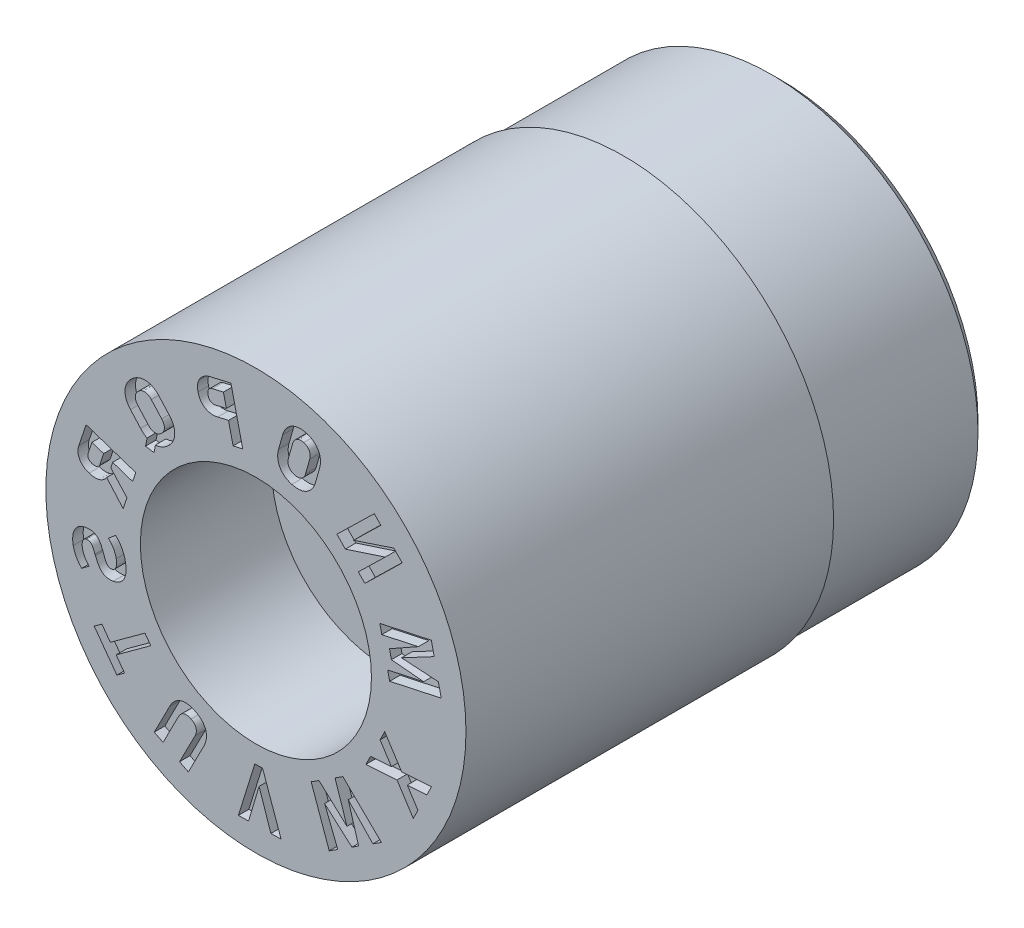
SolidWorks part; units mm, degrees
ref_plane "Front Plane" through (0, 0, 0) normal (0, 0, 1) x (1, 0, 0)
ref_plane "Top Plane" through (0, 0, 0) normal (0, 1, 0) x (1, 0, 0)
ref_plane "Right Plane" through (0, 0, 0) normal (1, 0, 0) x (0, 0, -1)
sketch "Sketch1" plane through (0, 0, 0) normal (1, 0, 0) x (0, 0, -1)
  line L2 (0, 4) -> (0, 2.2)
  line L3 (9.75, 4) -> (0, 4)
  line L4 (-3.7979, 0) -> (49996.2021, 0) construction
  line L8 (10, 1.15) -> (2.5, 1.15)
  line L9 (2.5, 2.2) -> (2.5, 1.15)
  line L10 (2.5, 2.2) -> (0, 2.2)
  line L12 (10, 1.15) -> (10, 3.75)
  line L16 (10, 3.75) -> (9.75, 4)
  dimension "D1" = 10
  dimension "D2" = 45
  dimension "D3" = 0.25
  dimension "D4" = 8
  dimension "D5" = 4.4
  dimension "D6" = 2.5
  dimension "D7" = 2.3
revolve "Revolve1" add sketch "Sketch1" angle 360 about L4
sketch "Sketch4" plane through (0, 0, 0) normal (1, 0, 0) x (0, 0, -1)
  line L0 (0, 0) -> (50000, 0) construction
  line L1 (10, -3.75) -> (10, 3.75) construction
  line L2 (7, 4.935) -> (10, 4.935)
  line L3 (7, 4.935) -> (7, 3.935)
  line L4 (7, 3.935) -> (10, 3.935)
  line L5 (10, 4.935) -> (10, 3.935)
  line L6 (9.75, 4) -> (0, 4) construction
  line L9 (0, 4.4) -> (0, -4.4) construction
  dimension "D1" = 1
  dimension "D2" = 0.065
  dimension "D3" = 7
revolve "Cut-Revolve1" cut sketch "Sketch4" angle 360 about L0
sketch "Sketch6" plane through (0, 0, 0) normal (0, 0, 1) x (1, 0, 0)
  line L0 (3.3942, 0.938) -> (3.3414, 1.1817)
  line L1 (3.3414, 1.1817) -> (2.36, 0.9694)
  line L2 (2.36, 0.9694) -> (2.3964, 0.8013)
  line L3 (2.3964, 0.8013) -> (3.094, 0.9523)
  line L5 (3.094, 0.9523) -> (2.545, 0.644)
  line L6 (2.545, 0.644) -> (2.5803, 0.4808)
  line L7 (2.5803, 0.4808) -> (3.1942, 0.4242)
  line L9 (3.1942, 0.4242) -> (2.51, 0.2761)
  line L10 (2.51, 0.2761) -> (2.5465, 0.108)
  line L11 (2.5465, 0.108) -> (3.5279, 0.3204)
  line L12 (3.5279, 0.3204) -> (3.4751, 0.564)
  line L13 (3.4751, 0.564) -> (2.7731, 0.6079)
  line L14 (2.7731, 0.6079) -> (3.3942, 0.938)
  line L15 (2.7863, 2.1794) -> (2.6263, 2.3435)
  line L16 (2.6263, 2.3435) -> (1.8581, 2.0885)
  line L18 (1.8581, 2.0885) -> (2.3794, 2.5967)
  line L19 (2.3794, 2.5967) -> (2.2542, 2.7252)
  line L20 (2.2542, 2.7252) -> (1.5424, 2.0312)
  line L21 (1.5424, 2.0312) -> (1.7034, 1.8661)
  line L22 (1.7034, 1.8661) -> (2.4633, 2.1147)
  line L24 (2.4633, 2.1147) -> (1.9495, 1.6137)
  line L25 (1.9495, 1.6137) -> (2.0745, 1.4854)
  line L26 (2.0745, 1.4854) -> (2.7863, 2.1794)
  line L27 (1.1352, 2.6801) -> (1.2122, 2.9529)
  line L28 (0.5092, 3.1513) -> (0.4321, 2.8786)
  line L29 (0.6188, 2.821) -> (0.6984, 3.1029)
  line L30 (1.0255, 3.0108) -> (0.9459, 2.7288)
  line L31 (-0.5623, 3.0525) -> (-0.7736, 3.0037)
  line L32 (-0.8295, 3.2458) -> (-0.6181, 3.2946)
  line L33 (-0.5216, 2.876) -> (-0.4345, 2.4988)
  line L34 (-2.072, 1.8105) -> (-2.1007, 1.662)
  line L35 (-0.7282, 2.8284) -> (-0.5216, 2.876)
  line L36 (-2.7277, 1.0821) -> (-2.3476, 0.9544)
  line L37 (-0.4756, 3.5133) -> (-0.8655, 3.4234)
  line L38 (-0.6181, 3.2946) -> (-0.5623, 3.0525)
  line L39 (-0.4345, 2.4988) -> (-0.2513, 2.541)
  line L40 (-0.2513, 2.541) -> (-0.4756, 3.5133)
  line L41 (-2.7722, -1.9089) -> (-2.9326, -1.6891)
  line L43 (-2.1007, 1.662) -> (-1.9397, 1.6333)
  line L44 (-1.9397, 1.6333) -> (-1.9124, 1.7752)
  line L45 (-1.6506, 2.3993) -> (-1.8409, 2.6116)
  line L46 (-2.388, 2.1211) -> (-2.1976, 1.9087)
  line L47 (-2.048, 2.0363) -> (-2.2447, 2.2557)
  line L48 (-1.9904, 2.4839) -> (-1.7937, 2.2644)
  line L49 (-2.8992, 1.1397) -> (-2.9736, 0.918)
  line L50 (-3.1957, 0.9928) -> (-3.1213, 1.2143)
  line L53 (-2.764, 0.974) -> (-2.7277, 1.0821)
  line L55 (-3.2331, 1.4498) -> (-3.3721, 1.036)
  line L56 (-3.1213, 1.2143) -> (-2.8992, 1.1397)
  line L57 (-2.3476, 0.9544) -> (-2.2877, 1.1322)
  line L58 (-2.2877, 1.1322) -> (-3.2331, 1.4498)
  line L60 (-2.8414, 0.7741) -> (-2.5279, 0.4177)
  line L61 (-2.5279, 0.4177) -> (-2.4555, 0.6334)
  line L62 (-2.4555, 0.6334) -> (-2.764, 0.974)
  line L63 (-2.6725, -0.0966) -> (-2.8093, -0.2101)
  line L64 (-2.7432, -0.6878) -> (-2.7438, -0.6878)
  line L65 (-2.8933, -0.5296) -> (-2.8982, -0.5151)
  line L66 (-3.2424, -0.2484) -> (-3.2431, -0.2487)
  line L67 (-3.3182, -0.9623) -> (-3.1757, -0.8554)
  line L68 (-3.2273, -0.4356) -> (-3.2267, -0.4354)
  line L69 (-2.7142, -0.8723) -> (-2.7128, -0.872)
  line L71 (-2.6614, -2.0609) -> (-2.0014, -1.5793)
  line L72 (-2.0014, -1.5793) -> (-2.1123, -1.4274)
  line L73 (-2.1123, -1.4274) -> (-2.7722, -1.9089)
  line L74 (-3.0791, -1.796) -> (-2.6478, -2.3873)
  line L75 (-2.6478, -2.3873) -> (-2.5012, -2.2805)
  line L76 (-2.5012, -2.2805) -> (-2.6614, -2.0609)
  line L77 (-2.9326, -1.6891) -> (-3.0791, -1.796)
  line L78 (-1.6441, -2.4041) -> (-1.9353, -2.9715)
  line L79 (-1.9353, -2.9715) -> (-1.7678, -3.0576)
  line L80 (-1.7678, -3.0576) -> (-1.4744, -2.4858)
  line L81 (-1.1601, -2.6471) -> (-1.4535, -3.2189)
  line L82 (-1.4535, -3.2189) -> (-1.2858, -3.3048)
  line L83 (-1.2858, -3.3048) -> (-0.9946, -2.7373)
  line L84 (-0.3338, -3.5443) -> (-0.1398, -3.5405)
  line L85 (-0.1398, -3.5405) -> (0.0596, -2.8694)
  line L86 (0.0596, -2.8694) -> (0.2851, -3.5322)
  line L87 (0.2851, -3.5322) -> (0.4791, -3.5284)
  line L88 (0.4791, -3.5284) -> (0.1269, -2.535)
  line L89 (0.1269, -2.535) -> (-0.0205, -2.5378)
  line L90 (-0.0205, -2.5378) -> (-0.3338, -3.5443)
  line L91 (1.829, -2.9867) -> (1.9564, -2.9054)
  line L92 (1.9564, -2.9054) -> (1.7582, -2.24)
  line L93 (1.7582, -2.24) -> (2.2261, -2.733)
  line L94 (2.2261, -2.733) -> (2.3895, -2.6285)
  line L95 (2.3895, -2.6285) -> (1.6565, -1.9099)
  line L96 (1.6565, -1.9099) -> (1.507, -2.0055)
  line L97 (1.507, -2.0055) -> (1.7339, -2.6898)
  line L98 (1.7339, -2.6898) -> (1.201, -2.2011)
  line L99 (1.201, -2.2011) -> (1.0515, -2.2967)
  line L100 (1.0515, -2.2967) -> (1.396, -3.2637)
  line L101 (1.396, -3.2637) -> (1.5595, -3.1592)
  line L102 (1.5595, -3.1592) -> (1.3084, -2.5276)
  line L103 (1.3084, -2.5276) -> (1.829, -2.9867)
  line L105 (2.6868, -1.4487) -> (2.9966, -1.929)
  line L106 (2.9966, -1.929) -> (3.0857, -1.7505)
  line L107 (3.0857, -1.7505) -> (2.8824, -1.4356)
  line L109 (2.7753, -1.2702) -> (2.4532, -0.7707)
  line L110 (2.4532, -0.7707) -> (2.364, -0.949)
  line L111 (2.364, -0.949) -> (2.5801, -1.2832)
  line L112 (2.8824, -1.4356) -> (3.2553, -1.4106)
  line L113 (3.2553, -1.4106) -> (3.3443, -1.2321)
  line L114 (3.3443, -1.2321) -> (2.7753, -1.2702)
  line L115 (2.5801, -1.2832) -> (2.184, -1.3097)
  line L116 (2.184, -1.3097) -> (2.0949, -1.4882)
  line L117 (2.0949, -1.4882) -> (2.6868, -1.4487)
  spline S0 degree 3 poles (0.6836, 2.4244) (0.7006, 2.4198) (0.7259, 2.4135) (0.76, 2.4093) (0.7848, 2.4075) (0.8093, 2.4071) (0.8333, 2.4084) (0.857, 2.4115) (0.8803, 2.416) (0.9029, 2.4222) (0.9248, 2.4299) (0.946, 2.4387) (0.9661, 2.4495) (0.9856, 2.4614) (1.0043, 2.4748) (1.0221, 2.4898) (1.0392, 2.5059) (1.0552, 2.5236) (1.0701, 2.5424) (1.0837, 2.5625) (1.0965, 2.5836) (1.1078, 2.6061) (1.1217, 2.638) (1.1305, 2.6629) (1.1352, 2.6801) knots 0 0 0 0 0.090194 0.133726 0.176131 0.217857 0.25895 0.299614 0.340319 0.380513 0.420146 0.459126 0.498043 0.537171 0.576533 0.615884 0.6563 0.697112 0.738186 0.77937 0.821548 0.864563 0.908535 1 1 1 1
  spline S1 degree 3 poles (1.2122, 2.9529) (1.217, 2.97) (1.2226, 2.9959) (1.2278, 3.0303) (1.2294, 3.0554) (1.23, 3.0801) (1.2284, 3.1043) (1.2258, 3.1282) (1.2212, 3.1515) (1.2154, 3.1743) (1.2078, 3.1963) (1.199, 3.2176) (1.1887, 3.238) (1.1767, 3.2575) (1.1637, 3.2764) (1.1489, 3.2942) (1.1328, 3.3112) (1.1155, 3.3274) (1.0967, 3.3421) (1.0769, 3.3558) (1.0561, 3.3687) (1.034, 3.38) (1.0025, 3.3936) (0.9779, 3.4023) (0.9609, 3.407) knots 0 0 0 0 0.091422 0.135457 0.178647 0.220379 0.261961 0.303177 0.343652 0.383839 0.423698 0.462887 0.502168 0.540991 0.580175 0.619644 0.659728 0.70027 0.741002 0.782211 0.823695 0.866341 0.909628 1 1 1 1
  spline S2 degree 3 poles (0.9609, 3.407) (0.9439, 3.4116) (0.9184, 3.418) (0.8843, 3.4221) (0.8595, 3.4243) (0.8351, 3.4243) (0.811, 3.4231) (0.7873, 3.42) (0.764, 3.4155) (0.7414, 3.4092) (0.7195, 3.4018) (0.6985, 3.3927) (0.6781, 3.3823) (0.6586, 3.3704) (0.6401, 3.3567) (0.622, 3.342) (0.6052, 3.3255) (0.5891, 3.3079) (0.5743, 3.289) (0.5603, 3.2692) (0.5479, 3.2478) (0.5363, 3.2255) (0.5224, 3.1936) (0.5139, 3.1685) (0.5092, 3.1513) knots 0 0 0 0 0.090479 0.133987 0.176211 0.218094 0.259165 0.299808 0.340491 0.380664 0.420007 0.45925 0.498027 0.537135 0.576341 0.616114 0.656419 0.69721 0.738262 0.779443 0.821603 0.864569 0.908518 1 1 1 1
  spline S3 degree 3 poles (0.4321, 2.8786) (0.4272, 2.8615) (0.4213, 2.8357) (0.4166, 2.8013) (0.4147, 2.7762) (0.4144, 2.7515) (0.4157, 2.7272) (0.4184, 2.7033) (0.4231, 2.68) (0.4289, 2.6572) (0.4363, 2.6352) (0.4452, 2.614) (0.4557, 2.5937) (0.4673, 2.574) (0.4807, 2.5554) (0.4953, 2.5373) (0.5115, 2.5203) (0.5288, 2.5041) (0.5476, 2.4894) (0.5673, 2.4756) (0.5883, 2.4631) (0.6103, 2.4514) (0.642, 2.4378) (0.6666, 2.4291) (0.6836, 2.4244) knots 0 0 0 0 0.091282 0.135439 0.178142 0.220334 0.261702 0.302901 0.343595 0.383766 0.423341 0.462797 0.501584 0.540552 0.579582 0.619478 0.659546 0.700072 0.740788 0.78198 0.823449 0.866054 0.909669 1 1 1 1
  spline S4 degree 3 poles (0.7347, 2.606) (0.7192, 2.6101) (0.6972, 2.6191) (0.671, 2.6359) (0.6542, 2.6505) (0.64, 2.6671) (0.6283, 2.6853) (0.6196, 2.7052) (0.6134, 2.7265) (0.6103, 2.7491) (0.6099, 2.781) (0.6144, 2.8051) (0.6188, 2.821) knots 0 0 0 0 0.175128 0.257335 0.337663 0.417031 0.494508 0.572748 0.652927 0.735489 0.820321 1 1 1 1
  spline S5 degree 3 poles (0.6984, 3.1029) (0.703, 3.1188) (0.7118, 3.1415) (0.7286, 3.1686) (0.7432, 3.1861) (0.7595, 3.2012) (0.7775, 3.2134) (0.7967, 3.2232) (0.8177, 3.2295) (0.8396, 3.2334) (0.8707, 3.2342) (0.8942, 3.2301) (0.9097, 3.2257) knots 0 0 0 0 0.179644 0.264038 0.346325 0.427164 0.505034 0.582875 0.661567 0.742349 0.824682 1 1 1 1
  spline S6 degree 3 poles (0.9097, 3.2257) (0.9253, 3.2217) (0.9472, 3.2125) (0.9735, 3.1958) (0.99, 3.1809) (1.0045, 3.1646) (1.016, 3.1463) (1.0249, 3.1264) (1.0308, 3.105) (1.0342, 3.0825) (1.0341, 3.0507) (1.03, 3.0266) (1.0255, 3.0108) knots 0 0 0 0 0.175239 0.25749 0.337988 0.417174 0.494693 0.572977 0.6537 0.735737 0.820223 1 1 1 1
  spline S7 degree 3 poles (0.9459, 2.7288) (0.9415, 2.7129) (0.9325, 2.6901) (0.9158, 2.6629) (0.9012, 2.6454) (0.8849, 2.6304) (0.867, 2.6182) (0.8476, 2.6085) (0.8268, 2.6019) (0.8047, 2.5983) (0.7736, 2.5976) (0.7501, 2.6014) (0.7347, 2.606) knots 0 0 0 0 0.179767 0.264884 0.347153 0.427263 0.505116 0.58294 0.662174 0.742451 0.825387 1 1 1 1
  spline S8 degree 3 poles (-0.7736, 3.0037) (-0.784, 3.0015) (-0.7997, 2.9994) (-0.8204, 3.0013) (-0.835, 3.0051) (-0.8489, 3.0105) (-0.8617, 3.0183) (-0.8736, 3.0275) (-0.8842, 3.0388) (-0.8937, 3.0516) (-0.9043, 3.0712) (-0.91, 3.0873) (-0.9123, 3.0986) knots 0 0 0 0 0.168779 0.249596 0.328432 0.407062 0.48572 0.564814 0.646319 0.730711 0.817085 1 1 1 1
  spline S9 degree 3 poles (-0.9123, 3.0986) (-0.9149, 3.11) (-0.9174, 3.1271) (-0.9165, 3.1496) (-0.9137, 3.1654) (-0.9093, 3.1803) (-0.9029, 3.194) (-0.8946, 3.2065) (-0.8846, 3.2175) (-0.8732, 3.2273) (-0.8551, 3.238) (-0.8401, 3.2435) (-0.8295, 3.2458) knots 0 0 0 0 0.184525 0.269847 0.354276 0.436138 0.514601 0.592866 0.670246 0.748708 0.829399 1 1 1 1
  spline S10 degree 3 poles (-0.8655, 3.4234) (-0.8943, 3.4171) (-0.9354, 3.4029) (-0.985, 3.3749) (-1.0172, 3.3503) (-1.0455, 3.3223) (-1.0688, 3.291) (-1.0877, 3.2569) (-1.1011, 3.22) (-1.11, 3.1809) (-1.114, 3.1252) (-1.109, 3.0828) (-1.1023, 3.0548) knots 0 0 0 0 0.179264 0.262914 0.345095 0.425467 0.504018 0.581987 0.661489 0.742357 0.824785 1 1 1 1
  spline S11 degree 3 poles (-1.1023, 3.0548) (-1.0957, 3.0268) (-1.0821, 2.9863) (-1.0538, 2.9382) (-1.0288, 2.9071) (-1.0004, 2.88) (-0.9687, 2.8577) (-0.934, 2.8401) (-0.8966, 2.8271) (-0.8568, 2.8196) (-0.8001, 2.816) (-0.7569, 2.8216) (-0.7282, 2.8284) knots 0 0 0 0 0.175741 0.257985 0.339044 0.418176 0.496191 0.574525 0.654742 0.736636 0.820446 1 1 1 1
  spline S12 degree 3 poles (-1.6766, 1.8779) (-1.6633, 1.8896) (-1.6447, 1.9082) (-1.6224, 1.9346) (-1.6076, 1.9549) (-1.5942, 1.9755) (-1.5823, 1.9967) (-1.5722, 2.0185) (-1.5635, 2.0407) (-1.5566, 2.0633) (-1.5511, 2.0859) (-1.5476, 2.1087) (-1.5458, 2.1315) (-1.5451, 2.1545) (-1.5465, 2.1776) (-1.5498, 2.2007) (-1.5543, 2.2239) (-1.5607, 2.247) (-1.5685, 2.2698) (-1.5783, 2.2923) (-1.5895, 2.3144) (-1.6024, 2.3362) (-1.6219, 2.3653) (-1.6388, 2.3858) (-1.6506, 2.3993) knots 0 0 0 0 0.090248 0.133974 0.176351 0.21819 0.259184 0.300165 0.340676 0.380906 0.42036 0.459207 0.498376 0.537338 0.576359 0.616026 0.656354 0.696955 0.738027 0.779458 0.821744 0.864572 0.908583 1 1 1 1
  spline S13 degree 3 poles (-1.8409, 2.6116) (-1.8527, 2.6252) (-1.8718, 2.6437) (-1.8983, 2.6666) (-1.9187, 2.6815) (-1.9395, 2.6951) (-1.9608, 2.7072) (-1.9826, 2.7176) (-2.0048, 2.7264) (-2.0274, 2.7336) (-2.05, 2.7393) (-2.0728, 2.743) (-2.0958, 2.7451) (-2.1187, 2.7456) (-2.1417, 2.7444) (-2.1648, 2.7417) (-2.1879, 2.737) (-2.2109, 2.7308) (-2.2336, 2.723) (-2.2559, 2.7135) (-2.278, 2.7026) (-2.2996, 2.69) (-2.3284, 2.6707) (-2.3487, 2.654) (-2.362, 2.6423) knots 0 0 0 0 0.0915 0.135421 0.178271 0.220577 0.262026 0.303121 0.343723 0.384021 0.423519 0.46273 0.501891 0.540855 0.57982 0.619323 0.659322 0.699924 0.740535 0.781797 0.823416 0.866037 0.909561 1 1 1 1
  spline S14 degree 3 poles (-2.362, 2.6423) (-2.3749, 2.6302) (-2.3941, 2.6122) (-2.416, 2.5854) (-2.431, 2.5653) (-2.4444, 2.5448) (-2.4562, 2.5235) (-2.4664, 2.5018) (-2.475, 2.4796) (-2.482, 2.4571) (-2.4874, 2.4345) (-2.4912, 2.4117) (-2.4931, 2.3888) (-2.4934, 2.3658) (-2.492, 2.3428) (-2.4891, 2.3196) (-2.4842, 2.2965) (-2.478, 2.2734) (-2.47, 2.2505) (-2.4603, 2.2281) (-2.4491, 2.2059) (-2.4362, 2.1841) (-2.4167, 2.1551) (-2.3998, 2.1346) (-2.388, 2.1211) knots 0 0 0 0 0.090259 0.133806 0.176368 0.21791 0.259235 0.299899 0.340421 0.380663 0.420128 0.459002 0.498182 0.537187 0.576219 0.615813 0.656259 0.696871 0.737954 0.779397 0.821695 0.864534 0.908558 1 1 1 1
  spline S15 degree 3 poles (-2.1976, 1.9087) (-2.1859, 1.8952) (-2.1668, 1.8766) (-2.1403, 1.8538) (-2.12, 1.8386) (-2.099, 1.8253) (-2.083, 1.8161) (-2.0739, 1.8115) (-2.072, 1.8105) knots 0 0 0 0 0.091507 0.13543 0.178459 0.220612 0.262064 0.272766 0.272766 0.272766 0.272766
  spline S16 degree 3 poles (-1.8032, 2.019) (-1.8153, 2.0082) (-1.8346, 1.9942) (-1.8629, 1.981) (-1.8844, 1.9749) (-1.9061, 1.9714) (-1.9279, 1.9714) (-1.9495, 1.9746) (-1.9708, 1.981) (-1.9917, 1.9902) (-2.0189, 2.0072) (-2.0371, 2.0237) (-2.048, 2.0363) knots 0 0 0 0 0.175141 0.256784 0.337393 0.416764 0.494645 0.572816 0.652902 0.735639 0.819694 1 1 1 1
  spline S17 degree 3 poles (-2.2447, 2.2557) (-2.2559, 2.268) (-2.2703, 2.2879) (-2.2845, 2.3167) (-2.2915, 2.3384) (-2.2955, 2.3603) (-2.2965, 2.3822) (-2.294, 2.4039) (-2.2883, 2.4252) (-2.2797, 2.4459) (-2.2636, 2.4726) (-2.2477, 2.4904) (-2.2356, 2.5012) knots 0 0 0 0 0.180084 0.264435 0.346804 0.426691 0.504877 0.582908 0.66255 0.743143 0.824841 1 1 1 1
  spline S18 degree 3 poles (-2.2356, 2.5012) (-2.2235, 2.5118) (-2.2042, 2.5261) (-2.1757, 2.539) (-2.1543, 2.5456) (-2.1325, 2.5486) (-2.1107, 2.5488) (-2.089, 2.5455) (-2.0677, 2.5392) (-2.0468, 2.5299) (-2.0199, 2.5125) (-2.0013, 2.4965) (-1.9904, 2.4839) knots 0 0 0 0 0.174919 0.257092 0.337885 0.416967 0.49475 0.573558 0.653542 0.735473 0.819742 1 1 1 1
  spline S19 degree 3 poles (-1.7937, 2.2644) (-1.7824, 2.2522) (-1.7683, 2.2322) (-1.7541, 2.2035) (-1.7471, 2.1817) (-1.7431, 2.1598) (-1.7421, 2.138) (-1.7445, 2.1163) (-1.7503, 2.0951) (-1.7589, 2.0744) (-1.7753, 2.0477) (-1.7911, 2.0297) (-1.8032, 2.019) knots 0 0 0 0 0.179662 0.264031 0.346417 0.426321 0.504524 0.582571 0.661503 0.742112 0.824804 1 1 1 1
  spline S20 degree 3 poles (-2.9736, 0.918) (-2.9764, 0.9093) (-2.9823, 0.897) (-2.9935, 0.8831) (-3.0033, 0.8744) (-3.0142, 0.8671) (-3.0261, 0.8612) (-3.0393, 0.8575) (-3.0534, 0.8553) (-3.0682, 0.8545) (-3.0893, 0.8563) (-3.1051, 0.8595) (-3.1156, 0.863) knots 0 0 0 0 0.161068 0.23633 0.312907 0.389938 0.4663 0.546541 0.629301 0.716596 0.806348 1 1 1 1
  spline S21 degree 3 poles (-3.1156, 0.863) (-3.126, 0.8667) (-3.1411, 0.8727) (-3.1587, 0.8844) (-3.1702, 0.8938) (-3.1801, 0.9041) (-3.1884, 0.9151) (-3.1943, 0.9271) (-3.1987, 0.9394) (-3.2011, 0.9524) (-3.2015, 0.9704) (-3.1989, 0.984) (-3.1957, 0.9928) knots 0 0 0 0 0.193239 0.282531 0.369322 0.452324 0.53163 0.608138 0.685234 0.760908 0.836972 1 1 1 1
  spline S22 degree 3 poles (-3.3721, 1.036) (-3.3806, 1.0114) (-3.3885, 0.9736) (-3.3892, 0.9231) (-3.384, 0.8871) (-3.3741, 0.8526) (-3.3593, 0.8198) (-3.3395, 0.7895) (-3.3153, 0.7614) (-3.2866, 0.7359) (-3.242, 0.7053) (-3.2038, 0.6889) (-3.1772, 0.6798) knots 0 0 0 0 0.170636 0.251235 0.330356 0.408725 0.48632 0.565007 0.645709 0.729339 0.815469 1 1 1 1
  spline S23 degree 3 poles (-3.1772, 0.6798) (-3.1506, 0.6708) (-3.1103, 0.6612) (-3.0563, 0.6587) (-3.0182, 0.6618) (-2.9818, 0.6694) (-2.9477, 0.6819) (-2.9161, 0.699) (-2.8872, 0.7205) (-2.8622, 0.7458) (-2.8477, 0.7645) (-2.8414, 0.7741) knots 0 0 0 0 0.184577 0.270219 0.353957 0.435258 0.513724 0.591599 0.670107 0.749359 0.824937 0.824937 0.824937 0.824937
  spline S24 degree 3 poles (-2.4833, -0.4436) (-2.4875, -0.4204) (-2.4957, -0.386) (-2.51, -0.3413) (-2.5223, -0.3087) (-2.5362, -0.2772) (-2.5516, -0.2468) (-2.5685, -0.2177) (-2.5868, -0.19) (-2.6065, -0.1639) (-2.6339, -0.1317) (-2.6565, -0.1098) (-2.6725, -0.0966) knots 0 0 0 0 0.175524 0.262635 0.349121 0.434717 0.519167 0.60273 0.685183 0.766328 0.845836 1 1 1 1
  spline S25 degree 3 poles (-2.8093, -0.2101) (-2.7902, -0.2262) (-2.7638, -0.2535) (-2.7335, -0.2945) (-2.7131, -0.3279) (-2.6952, -0.363) (-2.6752, -0.4119) (-2.6649, -0.4501) (-2.6602, -0.4759) knots 0 0 0 0 0.241531 0.364929 0.491181 0.619228 0.745917 1 1 1 1
  spline S26 degree 3 poles (-2.6602, -0.4759) (-2.6577, -0.4902) (-2.6544, -0.5112) (-2.6533, -0.5385) (-2.6529, -0.5573) (-2.6544, -0.575) (-2.6567, -0.5918) (-2.6604, -0.6073) (-2.6651, -0.6218) (-2.671, -0.635) (-2.6781, -0.6469) (-2.6863, -0.6573) (-2.6956, -0.6663) (-2.7058, -0.674) (-2.7214, -0.6822) (-2.7343, -0.6861) (-2.7432, -0.6878) knots 0 0 0 0 0.170861 0.249053 0.322477 0.39228 0.458186 0.520993 0.580728 0.637309 0.691419 0.742743 0.79328 0.84318 0.893202 1 1 1 1
  spline S27 degree 3 poles (-2.7438, -0.6878) (-2.7557, -0.6903) (-2.7735, -0.6908) (-2.7958, -0.685) (-2.8103, -0.6773) (-2.8234, -0.6673) (-2.8349, -0.6549) (-2.8456, -0.6409) (-2.8549, -0.6245) (-2.8634, -0.606) (-2.8761, -0.5768) (-2.8849, -0.5533) (-2.8906, -0.5366) knots 0 0 0 0 0.155371 0.225429 0.294698 0.364504 0.436527 0.51115 0.59084 0.677589 0.773762 1 1 1 1
  spline S28 degree 3 poles (-2.8906, -0.5366) (-2.8912, -0.5356) (-2.8924, -0.5333) (-2.8927, -0.5307) (-2.8933, -0.5296) knots 0 0 0 0 0.486527 1 1 1 1
  spline S29 degree 3 poles (-2.8982, -0.5151) (-2.9086, -0.4858) (-2.9243, -0.4438) (-2.9484, -0.3921) (-2.9658, -0.359) (-2.9857, -0.3296) (-3.0092, -0.3037) (-3.0373, -0.2817) (-3.0632, -0.2657) (-3.086, -0.2553) (-3.1046, -0.2492) (-3.1245, -0.2447) (-3.1457, -0.242) (-3.1681, -0.2412) (-3.2006, -0.2423) (-3.2255, -0.2453) (-3.2424, -0.2484) knots 0 0 0 0 0.190606 0.274057 0.349203 0.419846 0.490621 0.562624 0.637618 0.676455 0.716095 0.757524 0.800895 0.84657 0.894994 1 1 1 1
  spline S30 degree 3 poles (-3.2431, -0.2487) (-3.2585, -0.2513) (-3.2808, -0.2572) (-3.3096, -0.2665) (-3.3294, -0.2754) (-3.3484, -0.2847) (-3.3661, -0.2957) (-3.3828, -0.3076) (-3.3983, -0.3207) (-3.4127, -0.3349) (-3.4257, -0.3504) (-3.4377, -0.3666) (-3.4483, -0.384) (-3.4578, -0.4022) (-3.4661, -0.4216) (-3.473, -0.442) (-3.4788, -0.4634) (-3.4833, -0.4857) (-3.4867, -0.5089) (-3.4884, -0.5329) (-3.489, -0.5578) (-3.4885, -0.5836) (-3.4855, -0.6197) (-3.4819, -0.6472) (-3.4784, -0.6656) knots 0 0 0 0 0.085896 0.127211 0.167042 0.205922 0.244128 0.281822 0.319215 0.356182 0.393478 0.430644 0.467581 0.505859 0.544351 0.583807 0.624649 0.666823 0.70966 0.753991 0.799784 0.84715 0.896441 1 1 1 1
  spline S31 degree 3 poles (-3.4784, -0.6656) (-3.475, -0.6833) (-3.4688, -0.71) (-3.4568, -0.7448) (-3.4433, -0.7802) (-3.4223, -0.8233) (-3.3825, -0.8896) (-3.3454, -0.9346) (-3.3182, -0.9623) knots 0 0 0 0 0.158617 0.239721 0.32256 0.490632 0.659657 1 1 1 1
  spline S32 degree 3 poles (-3.1757, -0.8554) (-3.192, -0.8392) (-3.2144, -0.8133) (-3.241, -0.7766) (-3.2584, -0.7483) (-3.2735, -0.7196) (-3.2896, -0.6819) (-3.2977, -0.6528) (-3.3014, -0.6334) knots 0 0 0 0 0.265785 0.396258 0.525376 0.6507 0.771281 1 1 1 1
  spline S33 degree 3 poles (-3.3014, -0.6334) (-3.3038, -0.62) (-3.3065, -0.6003) (-3.3083, -0.5746) (-3.3082, -0.557) (-3.3074, -0.5403) (-3.3052, -0.5248) (-3.302, -0.5102) (-3.2977, -0.4967) (-3.2924, -0.4844) (-3.286, -0.4734) (-3.2787, -0.4636) (-3.2702, -0.4553) (-3.2609, -0.4482) (-3.2469, -0.4406) (-3.2354, -0.4368) (-3.2273, -0.4356) knots 0 0 0 0 0.1728 0.25226 0.327128 0.397072 0.4639 0.526869 0.586457 0.643228 0.696617 0.748591 0.797674 0.847121 0.895953 1 1 1 1
  spline S34 degree 3 poles (-3.2267, -0.4354) (-3.2138, -0.4329) (-3.1944, -0.4322) (-3.1701, -0.4386) (-3.1546, -0.4471) (-3.1409, -0.458) (-3.1283, -0.4707) (-3.1172, -0.4851) (-3.1073, -0.5016) (-3.0978, -0.5208) (-3.0829, -0.5525) (-3.0724, -0.5787) (-3.0651, -0.5973) knots 0 0 0 0 0.15693 0.226989 0.295779 0.365837 0.435732 0.507634 0.581723 0.66471 0.762052 1 1 1 1
  spline S35 degree 3 poles (-3.0651, -0.5973) (-3.064, -0.5988) (-3.0634, -0.6025) (-3.0618, -0.6058) (-3.0612, -0.6076) knots 0 0 0 0 0.500685 1 1 1 1
  spline S36 degree 3 poles (-3.0612, -0.6076) (-3.0603, -0.6101) (-3.0584, -0.6152) (-3.0556, -0.6198) (-3.0549, -0.6224) knots 0 0 0 0 0.505821 1 1 1 1
  spline S37 degree 3 poles (-3.0549, -0.6224) (-3.044, -0.6501) (-3.0271, -0.6897) (-3.0017, -0.7384) (-2.9834, -0.77) (-2.9625, -0.7977) (-2.9384, -0.822) (-2.9106, -0.8427) (-2.885, -0.8571) (-2.8627, -0.8666) (-2.8446, -0.8722) (-2.8254, -0.876) (-2.8052, -0.8785) (-2.7839, -0.8792) (-2.7534, -0.8785) (-2.73, -0.8751) (-2.7142, -0.8723) knots 0 0 0 0 0.18976 0.273414 0.349873 0.422015 0.494051 0.56678 0.642001 0.680861 0.720928 0.762336 0.805293 0.850452 0.897654 1 1 1 1
  spline S38 degree 3 poles (-2.7128, -0.872) (-2.6978, -0.8691) (-2.6756, -0.864) (-2.6476, -0.8538) (-2.6279, -0.8453) (-2.6092, -0.8357) (-2.5917, -0.8247) (-2.5754, -0.8124) (-2.5602, -0.799) (-2.546, -0.7844) (-2.5331, -0.7687) (-2.5214, -0.7519) (-2.5108, -0.7342) (-2.5017, -0.7151) (-2.4936, -0.6952) (-2.4869, -0.6741) (-2.4814, -0.652) (-2.477, -0.629) (-2.4741, -0.6051) (-2.4724, -0.5803) (-2.4718, -0.5546) (-2.4728, -0.528) (-2.4756, -0.4908) (-2.48, -0.4626) (-2.4833, -0.4436) knots 0 0 0 0 0.083567 0.123559 0.162477 0.200501 0.237895 0.274918 0.311707 0.348478 0.385629 0.422392 0.459802 0.498038 0.537339 0.57712 0.618612 0.661155 0.704712 0.749938 0.79662 0.84474 0.894529 1 1 1 1
  spline S39 degree 3 poles (-1.1502, -2.2395) (-1.1668, -2.2312) (-1.1917, -2.2198) (-1.2255, -2.2073) (-1.2501, -2.2002) (-1.2745, -2.1947) (-1.2984, -2.1907) (-1.3221, -2.1886) (-1.3455, -2.1881) (-1.3684, -2.1892) (-1.3909, -2.1922) (-1.4128, -2.1966) (-1.4343, -2.2029) (-1.4551, -2.2108) (-1.4755, -2.2204) (-1.4953, -2.2316) (-1.5146, -2.2445) (-1.5334, -2.2589) (-1.5513, -2.2751) (-1.5685, -2.2928) (-1.5851, -2.312) (-1.6011, -2.3327) (-1.6218, -2.3629) (-1.6354, -2.3873) (-1.6441, -2.4041) knots 0 0 0 0 0.094225 0.138798 0.182169 0.224093 0.264972 0.304984 0.344558 0.383408 0.421281 0.459331 0.496553 0.53428 0.572077 0.610496 0.64975 0.689691 0.730201 0.771783 0.814601 0.858801 0.904194 1 1 1 1
  spline S40 degree 3 poles (-1.4744, -2.4858) (-1.4681, -2.4738) (-1.4583, -2.4564) (-1.442, -2.4363) (-1.4297, -2.4231) (-1.4166, -2.4117) (-1.4028, -2.4019) (-1.388, -2.3942) (-1.3727, -2.3879) (-1.3567, -2.3836) (-1.3404, -2.3809) (-1.3237, -2.3803) (-1.3066, -2.3818) (-1.2891, -2.3847) (-1.2648, -2.3917) (-1.247, -2.3993) (-1.2352, -2.4053) knots 0 0 0 0 0.141624 0.207266 0.270211 0.330127 0.389068 0.446408 0.504103 0.561615 0.618775 0.676675 0.736135 0.797895 0.861549 1 1 1 1
  spline S41 degree 3 poles (-1.2352, -2.4053) (-1.2231, -2.4111) (-1.2067, -2.4217) (-1.1865, -2.4373) (-1.1739, -2.4498) (-1.1628, -2.4631) (-1.1535, -2.4771) (-1.1459, -2.4918) (-1.1401, -2.5073) (-1.1362, -2.5234) (-1.1339, -2.5399) (-1.1336, -2.5568) (-1.1354, -2.5742) (-1.1387, -2.5919) (-1.146, -2.6167) (-1.1538, -2.6351) (-1.1601, -2.6471) knots 0 0 0 0 0.139099 0.203175 0.26497 0.324582 0.382665 0.439927 0.497106 0.554285 0.611913 0.670426 0.730624 0.793208 0.858212 1 1 1 1
  spline S42 degree 3 poles (-0.9946, -2.7373) (-0.9861, -2.7205) (-0.9745, -2.6951) (-0.9617, -2.6608) (-0.9543, -2.6357) (-0.9482, -2.611) (-0.9441, -2.5867) (-0.9416, -2.5627) (-0.9407, -2.5391) (-0.9416, -2.5158) (-0.944, -2.4931) (-0.9484, -2.4709) (-0.9539, -2.4493) (-0.9616, -2.4283) (-0.9707, -2.4078) (-0.9818, -2.3879) (-0.9942, -2.3685) (-1.0081, -2.3497) (-1.0239, -2.3317) (-1.0411, -2.3144) (-1.0598, -2.2977) (-1.0802, -2.282) (-1.1098, -2.2616) (-1.1335, -2.2478) (-1.1502, -2.2395) knots 0 0 0 0 0.095616 0.140884 0.185213 0.227848 0.269395 0.3098 0.34973 0.388897 0.42751 0.465331 0.502852 0.540374 0.578244 0.616303 0.655185 0.694704 0.73474 0.775807 0.81807 0.861446 0.906008 1 1 1 1
  spline S43 degree 3 poles (-1.9124, 1.7752) (-1.9072, 1.7754) (-1.8944, 1.7762) (-1.8737, 1.7787) (-1.8506, 1.7834) (-1.8275, 1.7893) (-1.8048, 1.7971) (-1.7825, 1.8066) (-1.7604, 1.8174) (-1.7391, 1.8304) (-1.71, 1.8493) (-1.69, 1.8663) (-1.6766, 1.8779) knots 0.55368 0.55368 0.55368 0.55368 0.579879 0.619385 0.659717 0.700196 0.74081 0.782075 0.823696 0.866251 0.909555 1 1 1 1
extrude "Cut-Extrude1" cut sketch "Sketch6" against normal blind 0.2
